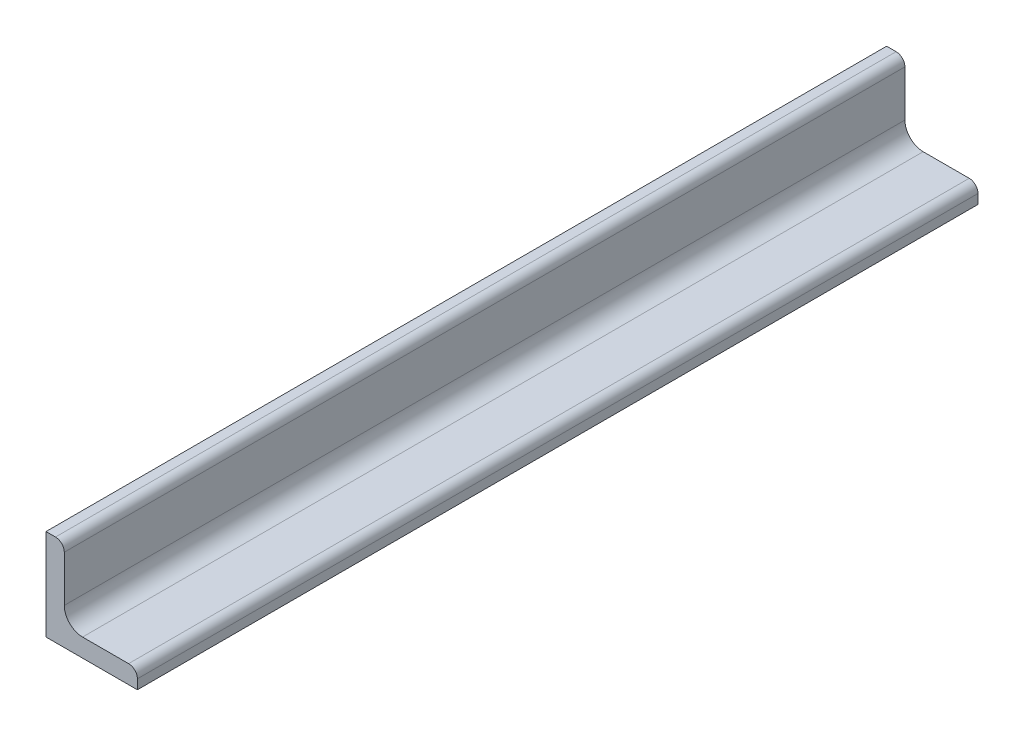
SolidWorks part; units mm, degrees
ref_plane "Plane1" through (0, 0, 0) normal (0, 0, 1) x (1, 0, 0)
ref_plane "Plane2" through (0, 0, 0) normal (0, 1, 0) x (1, 0, 0)
ref_plane "Plane3" through (0, 0, 0) normal (1, 0, 0) x (0, 0, -1)
extrude "BaseSteelAngle" add sketch "Sketch1" along normal mid plane 230
sketch "Sketch1" plane through (0, 0, 0) normal (0, 0, 1) x (1, 0, 0)
  line L0 (0, 25) -> (0, 0)
  line L1 (0, 25) -> (9.525, 25) construction
  line L2 (5, 25) -> (5, 10)
  line L3 (10, 5) -> (25, 5)
  line L4 (25, 9.525) -> (25, 0) construction
  line L5 (25, 0) -> (0, 0)
  line L6 (25, 5) -> (25, 0)
  line L7 (0, 25) -> (5, 25)
  arc A2 (10, 5) -> (5, 10) centre (10, 10) cw
  dimension "Radius_1" = 5
  dimension "V_leg" = 25
  dimension "H_leg" = 25
  dimension "thickness" = 5
fillet "ToeFillet" radius 2.4 2 edges at (5, 25, 0) (25, 5, 0)
